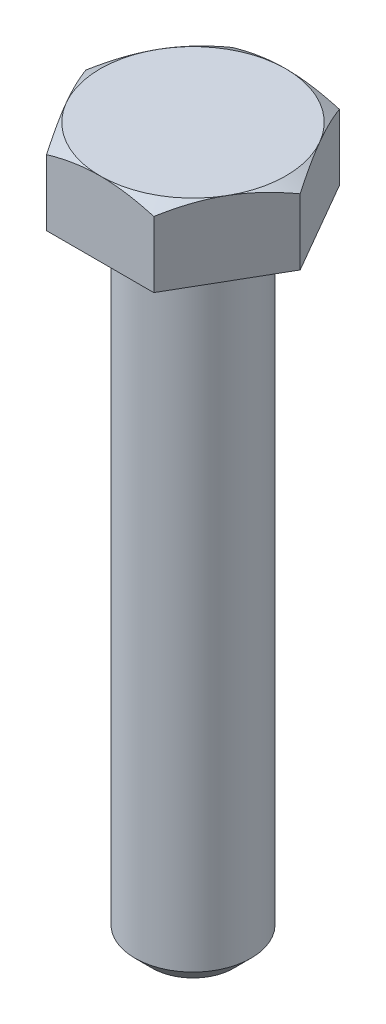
SolidWorks part; units mm, degrees
extrude "Base-Extrusion" add sketch "Esquisse2" against normal blind 55
sketch "Esquisse2" plane through (0, 0, 0) normal (0, 1, 0) x (1, 0, 0)
  circle A0 centre (0, 0) radius 5
  dimension "Diamètre nominal" = 10
chamfer "Chanfrein1" distance 1.4521 angle 45
ref_plane "Plan1" through (0, 0, 0) normal (0, 0, 1) x (1, 0, 0)
ref_plane "Plan2" through (0, 0, 0) normal (0, 1, 0) x (1, 0, 0)
ref_plane "Plan3" through (0, 0, 0) normal (1, 0, 0) x (0, 0, -1)
sketch "Esquisse5" plane through (0, 0, 0) normal (0, 0, 1) x (1, 0, 0)
  line L0 (-8, 0) -> (8, 0) construction
  line L1 (0, 0) -> (11.3137, 0)
  line L2 (0, 0) -> (0, 6.4)
  line L3 (0, 6.4) -> (8, 6.4)
  line L5 (11.3137, 0) -> (11.3137, 4.4868)
  line L6 (8, 6.4) -> (11.3137, 4.4868)
  line L7 (0, 6.4) -> (0, -55) construction
  line L8 (0, -53.5) -> (0, 0) construction
  line L9 (-3.5, -55) -> (3.5, -55) construction
revolve "Boss.-Révol.1" add sketch "Esquisse5" angle 360 about L7
sketch "Esquisse6" plane through (0, 0, 0) normal (0, -1, 0) x (1, 0, 0)
  line L0 (9.2376, 0) -> (-8, 0) construction
  line L1 (0, 0) -> (5.6569, -9.798) construction
  line L2 (0, 0) -> (9.798, -5.6569) construction
  line L3 (0, 0) -> (0, -8) construction
  line L4 (-4.6188, -8) -> (4.6188, -8)
  line L5 (4.6188, -8) -> (9.2376, 0)
  line L6 (-4.6188, 8) -> (4.6188, 8)
  line L7 (4.6188, 8) -> (9.2376, 0)
  line L8 (-4.6188, -8) -> (-9.2376, 0)
  line L9 (-4.6188, 8) -> (-9.2376, 0)
  circle A0 centre (0, 0) radius 11.3137 construction
  circle A3 centre (0, 0) radius 8 construction
  point P17 (0, 8)
  dimension "D1" = 30
  dimension "D2" = 30
extrude "Enlèv. mat.-Extru.1" cut sketch "Esquisse6" against normal blind 6.4 flip side to cut
equation "\"D4@Esquisse5\" = \"Cote sur plats@Esquisse5\"/2"
equation "\"D1@Esquisse5\" =(\"D4@Esquisse5\"*sqr(2)*2)/2"
